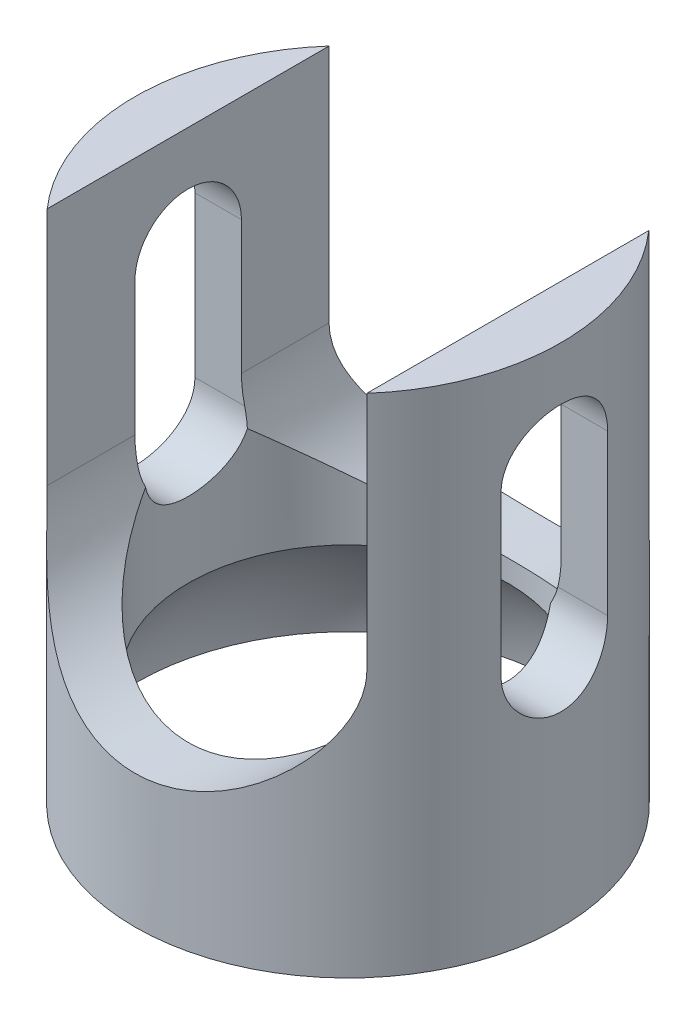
SolidWorks part; units mm, degrees
ref_plane "Front Plane" through (0, 0, 0) normal (0, 0, 1) x (1, 0, 0)
ref_plane "Top Plane" through (0, 0, 0) normal (0, 1, 0) x (1, 0, 0)
ref_plane "Right Plane" through (0, 0, 0) normal (1, 0, 0) x (0, 0, -1)
sketch "Sketch2" plane through (0, 0, 0) normal (0, 1, 0) x (1, 0, 0)
  circle A0 centre (0, 0) radius 4
  circle A1 centre (0, 0) radius 3
extrude "Boss-Extrude1" add sketch "Sketch2" against normal blind 9.5
sketch "Sketch4" plane through (0, 0, 0) normal (1, 0, 0) x (0, 0, -1)
  line L0 (-1, -2) -> (-1, -5)
  line L1 (1, -5) -> (1, -2)
  arc A0 (1, -2) -> (-1, -2) centre (0, -2) ccw
  arc A1 (-1, -5) -> (1, -5) centre (0, -5) ccw
  point P6 (0, -1)
extrude "Cut-Extrude1" cut sketch "Sketch4" against normal through all and the other way through all
sketch "Sketch5" plane through (0, 0, 0) normal (0, 0, 1) x (1, 0, 0)
  line L0 (-3, 0) -> (-3, -4.5)
  line L1 (3, 0) -> (-3, 0) construction
  line L2 (-3, 0) -> (3, 0)
  line L3 (4, 0) -> (-4, 0) construction
  line L4 (3, 0) -> (3, -4.5)
  ellipse E0 centre (0, -4.5) end of major axis (3, -4.5) minor radius 2.5 (-3, -4.5) -> (3, -4.5) ccw
extrude "Cut-Extrude2" cut sketch "Sketch5" against normal through all and the other way through all
sketch "Sketch6" plane through (0, 0, 0) normal (0, 0, 1) x (1, 0, 0)
  line L0 (-3, -12.7) -> (3, -12.7) construction
  line L1 (3.2338, -7.7) -> (-3.2338, -7.7) construction
  line L2 (-3, -9.5) -> (3, -9.5) construction
  line L3 (0, -10.0542) -> (0, 0) construction
  line L4 (0, -5.0271) -> (0, -14.0542)
  circle A0 centre (0, -10.0542) radius 4
  dimension "D1" = 8
  dimension "D2" = 6
  dimension "D3" = 5
  dimension "D4" = 1.8
revolve "Cut-Revolve3" cut sketch "Sketch6" angle 360 about L4
sketch "Sketch7" plane through (0, 0, 0) normal (0, 0, 1) x (1, 0, 0)
  point P0 (0, -10.0542)
sketch "Sketch8" plane through (-3, 0, 0) normal (1, 0, 0) x (0, 0, -1)
  line L0 (0, -2) -> (0, -5)
equation "\"OuterD\"= 8"
equation "\"Height\"= 9.5"
equation "\"InnerD\"= 6"
equation "\"PinTravel\"= 3"
equation "\"TopPinThi\"= 1"
equation "\"PinD\"= 2"
equation "\"RodWid\"= 6"
equation "\"RodHei\"= 2.5"
equation "\"ToptoRodBot\"=7"
